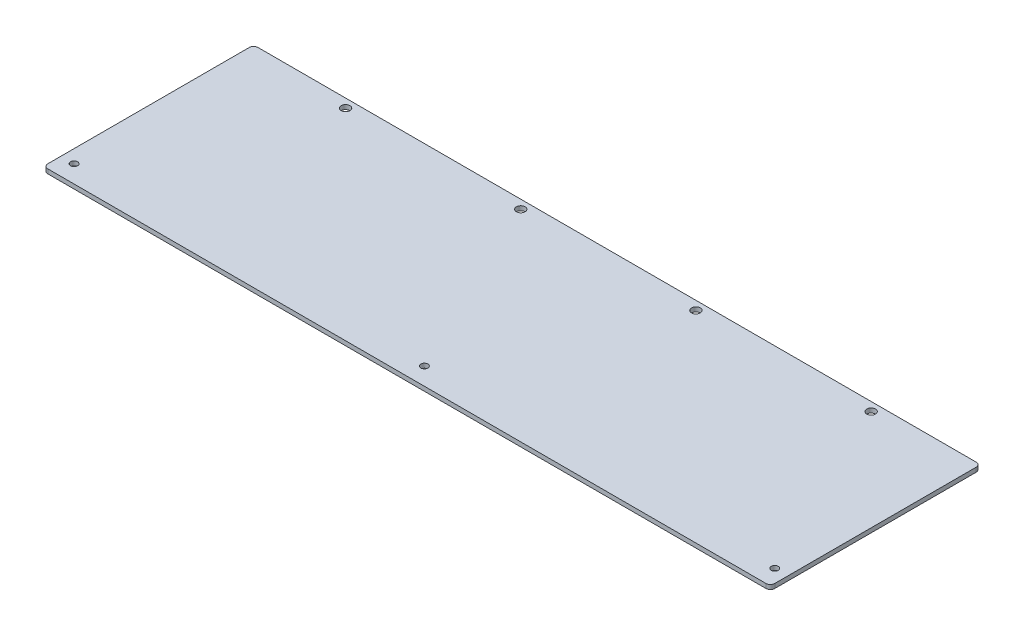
SolidWorks part; units mm, degrees
ref_plane "Front Plane" through (0, 0, 0) normal (0, 0, 1) x (1, 0, 0)
ref_plane "Top Plane" through (0, 0, 0) normal (0, 1, 0) x (1, 0, 0)
ref_plane "Right Plane" through (0, 0, 0) normal (1, 0, 0) x (0, 0, -1)
sketch "Sketch1" plane through (0, 0, 0) normal (0, 1, 0) x (1, 0, 0)
  line L1 (-263.525, 76.2) -> (263.525, 76.2)
  line L2 (-263.525, 76.2) -> (-263.525, -76.2)
  line L3 (-263.525, -76.2) -> (263.525, -76.2)
  line L4 (263.525, 76.2) -> (263.525, -76.2)
  line L5 (-263.525, 76.2) -> (263.525, -76.2) construction
  line L6 (-263.525, -76.2) -> (263.525, 76.2) construction
  point P0 (0, 0)
  point P6 (0, -63.5)
  point P10 (25.4, -63.5)
  point P11 (50.8, -63.5)
  point P12 (76.2, -63.5)
  point P13 (101.6, -63.5)
  point P14 (127, -63.5)
  point P15 (152.4, -63.5)
  point P16 (177.8, -63.5)
  point P17 (203.2, -63.5)
  point P18 (228.6, -63.5)
  point P19 (254, -63.5)
  point P20 (0, -63.5)
  point P21 (25.4, -63.5)
  point P22 (50.8, -63.5)
  point P23 (76.2, -63.5)
  point P24 (101.6, -63.5)
  point P25 (127, -63.5)
  point P26 (152.4, -63.5)
  point P27 (177.8, -63.5)
  point P28 (203.2, -63.5)
  point P29 (228.6, -63.5)
  point P30 (-25.4, -63.5)
  point P31 (0, -63.5)
  point P32 (25.4, -63.5)
  point P33 (50.8, -63.5)
  point P34 (76.2, -63.5)
  point P35 (101.6, -63.5)
  point P36 (127, -63.5)
  point P37 (152.4, -63.5)
  point P38 (177.8, -63.5)
  point P39 (203.2, -63.5)
  point P40 (-50.8, -63.5)
  point P41 (-25.4, -63.5)
  point P42 (0, -63.5)
  point P43 (25.4, -63.5)
  point P44 (50.8, -63.5)
  point P45 (76.2, -63.5)
  point P46 (101.6, -63.5)
  point P47 (127, -63.5)
  point P48 (152.4, -63.5)
  point P49 (177.8, -63.5)
  point P50 (-76.2, -63.5)
  point P51 (-50.8, -63.5)
  point P52 (-25.4, -63.5)
  point P53 (0, -63.5)
  point P54 (25.4, -63.5)
  point P55 (50.8, -63.5)
  point P56 (76.2, -63.5)
  point P57 (101.6, -63.5)
  point P58 (127, -63.5)
  point P59 (152.4, -63.5)
  point P60 (-101.6, -63.5)
  point P61 (-76.2, -63.5)
  point P62 (-50.8, -63.5)
  point P63 (-25.4, -63.5)
  point P64 (0, -63.5)
  point P65 (25.4, -63.5)
  point P66 (50.8, -63.5)
  point P67 (76.2, -63.5)
  point P68 (101.6, -63.5)
  point P69 (127, -63.5)
  point P70 (-127, -63.5)
  point P71 (-101.6, -63.5)
  point P72 (-76.2, -63.5)
  point P73 (-50.8, -63.5)
  point P74 (-25.4, -63.5)
  point P75 (0, -63.5)
  point P76 (25.4, -63.5)
  point P77 (50.8, -63.5)
  point P78 (76.2, -63.5)
  point P79 (101.6, -63.5)
  point P80 (-152.4, -63.5)
  point P81 (-127, -63.5)
  point P82 (-101.6, -63.5)
  point P83 (-76.2, -63.5)
  point P84 (-50.8, -63.5)
  point P85 (-25.4, -63.5)
  point P86 (0, -63.5)
  point P87 (25.4, -63.5)
  point P88 (50.8, -63.5)
  point P89 (76.2, -63.5)
  point P90 (-177.8, -63.5)
  point P91 (-152.4, -63.5)
  point P92 (-127, -63.5)
  point P93 (-101.6, -63.5)
  point P94 (-76.2, -63.5)
  point P95 (-50.8, -63.5)
  point P96 (-25.4, -63.5)
  point P97 (0, -63.5)
  point P98 (25.4, -63.5)
  point P99 (50.8, -63.5)
  point P100 (-203.2, -63.5)
  point P101 (-177.8, -63.5)
  point P102 (-152.4, -63.5)
  point P103 (-127, -63.5)
  point P104 (-101.6, -63.5)
  point P105 (-76.2, -63.5)
  point P106 (-50.8, -63.5)
  point P107 (-25.4, -63.5)
  point P108 (0, -63.5)
  point P109 (25.4, -63.5)
  point P110 (-228.6, -63.5)
  point P111 (-203.2, -63.5)
  point P112 (-177.8, -63.5)
  point P113 (-152.4, -63.5)
  point P114 (-127, -63.5)
  point P115 (-101.6, -63.5)
  point P116 (-76.2, -63.5)
  point P117 (-50.8, -63.5)
  point P118 (-25.4, -63.5)
  point P119 (0, -63.5)
  point P120 (-25.4, -63.5)
  point P121 (-50.8, -63.5)
  point P122 (-76.2, -63.5)
  point P123 (-101.6, -63.5)
  point P124 (-127, -63.5)
  point P125 (-152.4, -63.5)
  point P126 (-177.8, -63.5)
  point P127 (-203.2, -63.5)
  point P128 (-228.6, -63.5)
  point P129 (-254, -63.5)
  dimension "D1" = 152.4
  dimension "D2" = 527.05
  dimension "D3" = 12.7
  dimension "D6" = 25.4
  dimension "D7" = 25.4
  dimension "D4" = 11
  dimension "D5" = 11
extrude "Boss-Extrude1" add sketch "Sketch1" along normal blind 3.175
hole_wizard "#7 (0.201) Diameter Hole1" positions "Sketch2" profile "Sketch3" hole size "#7" standard "ANSI Inch"
sketch "Sketch2" plane through (0, 0, 0) normal (0, -1, 0) x (-1, 0, 0)
  point P0 (-254, -63.5)
  point P30 (0, -63.5)
  point P60 (254, -63.5)
sketch "Sketch3" plane through (254, 0, 63.5) normal (1, 0, 0) x (0, 0, -1)
  line L0 (0, 0) -> (0, 3.175)
  line L1 (0, 3.175) -> (2.5527, 3.175)
  line L2 (2.5527, 3.175) -> (2.5527, 0)
  line L5 (2.5527, 0) -> (0, 0)
  line L11 (0, -6.35) -> (0, 107.95) construction
  dimension "Thru Hole Dia." = 5.1054
  dimension "Thru Hole Depth" = 3.175
fillet "Fillet1" radius 3.175 4 edges at (-263.525, 1.5875, 76.2) (-263.525, 1.5875, -76.2) (263.525, 1.5875, 76.2) (263.525, 1.5875, -76.2)
hole_wizard "1/4 (0.25) Diameter Hole1" positions "Sketch4" profile "Sketch5" hole size "1/4" standard "ANSI Inch"
sketch "Sketch4" plane through (0, 3.175, 0) normal (0, 1, 0) x (1, 0, 0)
  line L0 (260.35, 76.2) -> (-260.35, 76.2) construction
  point P0 (190.5, 69.85)
  point P2 (63.5, 69.85)
  point P4 (-63.5, 69.85)
  point P6 (-190.5, 69.85)
  dimension "D1" = 127
  dimension "D2" = 127
  dimension "D3" = 127
  dimension "D4" = 63.5
  dimension "D5" = 6.35
sketch "Sketch5" plane through (190.5, 3.175, -69.85) normal (1, 0, 0) x (0, 0, 1)
  line L0 (0, 0) -> (0, 3.175)
  line L1 (0, 3.175) -> (3.175, 3.175)
  line L2 (3.175, 3.175) -> (3.175, 0)
  line L5 (3.175, 0) -> (0, 0)
  line L11 (0, -6.35) -> (0, 107.95) construction
  dimension "Thru Hole Dia." = 6.35
  dimension "Thru Hole Depth" = 3.175
